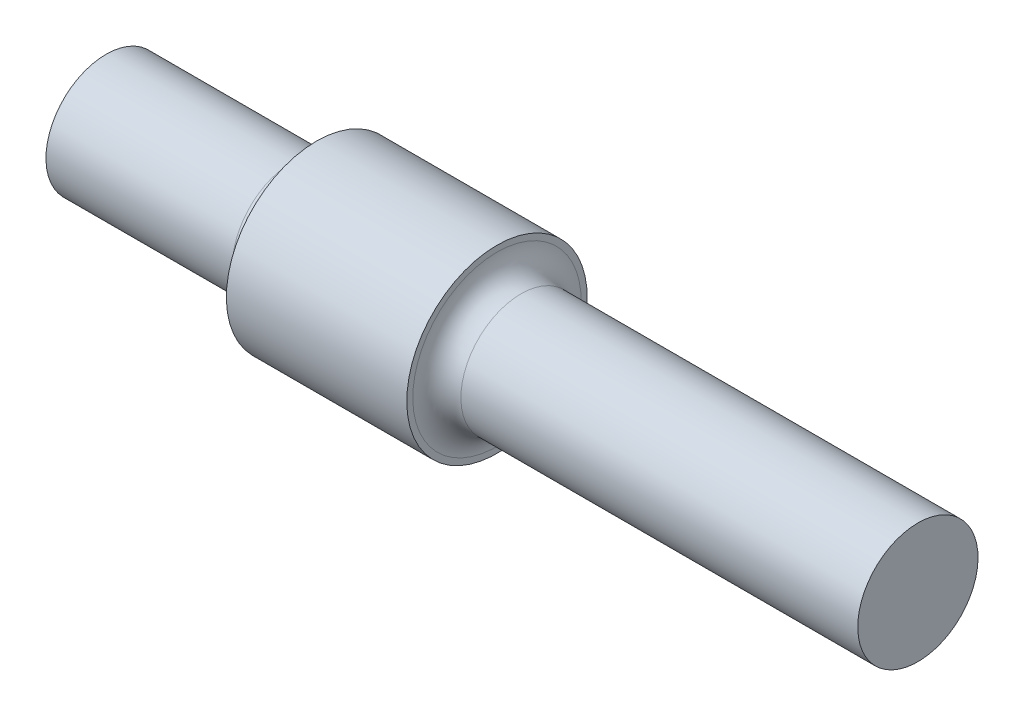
SolidWorks part; units mm, degrees
ref_plane "Front Plane" through (0, 0, 0) normal (0, 0, 1) x (1, 0, 0)
ref_plane "Top Plane" through (0, 0, 0) normal (0, 1, 0) x (1, 0, 0)
ref_plane "Right Plane" through (0, 0, 0) normal (1, 0, 0) x (0, 0, -1)
sketch "Sketch1" plane through (0, 0, 0) normal (0, 0, 1) x (1, 0, 0)
  line L0 (0, 15) -> (0, 25)
  line L1 (0, 25) -> (35, 25)
  line L2 (35, 25) -> (35, 30)
  line L3 (35, 30) -> (65, 30)
  line L4 (65, 30) -> (65, 25)
  line L5 (65, 25) -> (135, 25)
  line L6 (135, 25) -> (135, 15)
  line L7 (135, 15) -> (0, 15)
  line L8 (0, 0) -> (0, 30) construction
revolve "Revolve1" add sketch "Sketch1" angle 360 about L7
fillet "Fillet1" radius 4 2 edges at (65, 25, 0) (35, 25, 0)
sketch "Sketch2" plane through (0, 0, 0) normal (0, 1, 0) x (1, 0, 0)
  line L0 (57.5, 2.5) -> (42.5, 2.5)
  line L1 (42.5, -2.5) -> (57.5, -2.5)
  line L2 (42.5, 0) -> (35, 0) construction
  line L3 (35, 14) -> (35, -14) construction
  line L4 (57.5, 0) -> (65, 0) construction
  line L5 (65, -15) -> (65, 15) construction
  arc A0 (42.5, 2.5) -> (42.5, -2.5) centre (42.5, 0) ccw
  arc A1 (57.5, -2.5) -> (57.5, 2.5) centre (57.5, 0) ccw
extrude "Cut-Extrude1" cut sketch "Sketch2" along normal blind 2.5
equation "\"shaft diameter\"= 20"
equation "\"facewidth\"= 20mm"
equation "\"D1@Fillet1\"=\"shaft diameter\" / 5"
equation "\"D5@Sketch1\"= 1.5 * \"shaft diameter\""
equation "\"keywidth\"= 5mm"
equation "\"key height\"= 5mm"
equation "\"D1@Sketch2\"= \"keywidth\""
equation "\"D2@Sketch2\"= \"facewidth\" - \"keywidth\""
equation "\"D1@Cut-Extrude1\"= \"key height\" / 2"
equation "\"D2@Sketch1\"= \"facewidth\" + 10"
equation "\"D3@Sketch1\"= \"shaft diameter\" /2"
equation "\"D4@Sketch1\"= 0.25 *\"shaft diameter\""
